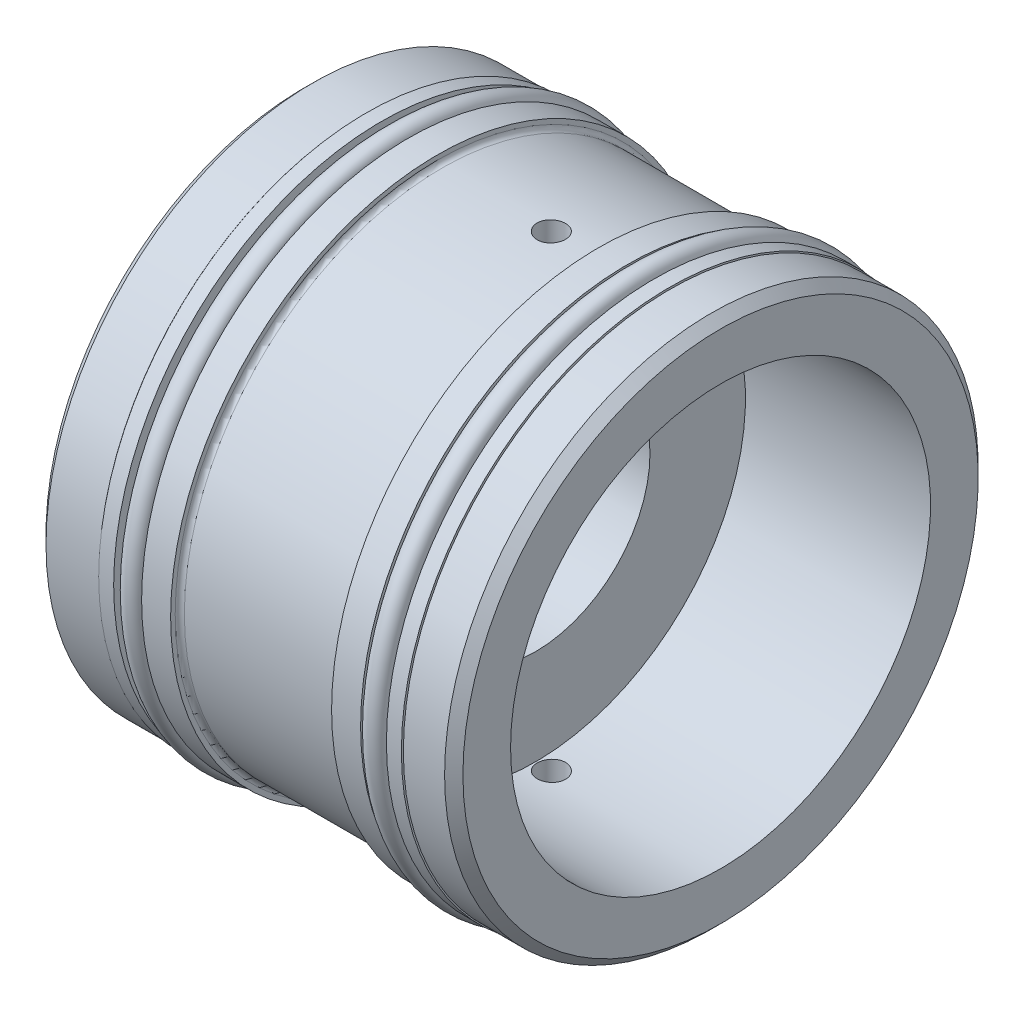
SolidWorks part; units mm, degrees
ref_plane "Front Plane" through (0, 0, 0) normal (0, 0, 1) x (1, 0, 0)
ref_plane "Top Plane" through (0, 0, 0) normal (0, 1, 0) x (1, 0, 0)
ref_plane "Right Plane" through (0, 0, 0) normal (1, 0, 0) x (0, 0, -1)
sketch "Sketch1" plane through (0, 0, 0) normal (0, 0, 1) x (1, 0, 0)
  line L0 (0, 0) -> (0, 45.5562) construction
  line L1 (0, 0) -> (32.8567, 0) construction
  line L2 (-17.3355, 9.525) -> (-17.3355, 22.1869)
  line L3 (-17.3355, 22.1869) -> (-12.1793, 22.1869)
  line L4 (-12.1793, 22.1869) -> (-12.1793, 20.9296)
  line L5 (-12.1793, 20.9296) -> (-8.6233, 20.9296)
  line L6 (-8.6233, 20.9296) -> (-8.6233, 22.1869)
  line L7 (-8.6233, 22.1869) -> (-6.2103, 22.1869)
  line L8 (-6.2103, 22.1869) -> (-6.2103, 21.4249)
  line L9 (-6.2103, 21.4249) -> (7.1755, 21.4249)
  line L10 (-17.3355, 9.525) -> (1.9431, 9.525)
  line L11 (1.9431, 9.525) -> (1.9431, 17.4625)
  line L12 (1.9431, 17.4625) -> (17.3355, 17.4625)
  line L13 (7.1755, 22.1869) -> (7.1755, 21.4249)
  line L14 (9.5885, 22.1869) -> (7.1755, 22.1869)
  line L15 (9.5885, 20.9296) -> (9.5885, 22.1869)
  line L16 (13.1445, 20.9296) -> (9.5885, 20.9296)
  line L17 (13.1445, 22.1869) -> (13.1445, 20.9296)
  line L18 (17.3355, 22.1869) -> (13.1445, 22.1869)
  line L19 (17.3355, 22.1869) -> (17.3355, 17.4625)
  dimension "D2" = 3.556
  dimension "D3" = 13.3858
  dimension "D4" = 44.3738
  dimension "D5" = 34.671
  dimension "D6" = 34.925
  dimension "D7" = 15.3924
  dimension "D8" = 42.8498
  dimension "D9" = 41.8592
  dimension "D10" = 19.05
  dimension "D11" = 29.5148
  dimension "D12" = 2.413
  dimension "D13" = 2.413
revolve "Revolve1" add sketch "Sketch1" angle 360 about L1
fillet "Fillet1" radius 0.381 2 edges at (7.1755, 0, 21.4249) (-6.2103, 0, 21.4249)
chamfer "Chamfer1" distance 0.762 angle 45 2 edges at (17.3355, 0, 22.1869) (-17.3355, 0, 22.1869)
sketch "Sketch6" plane through (0, 0, 0) normal (0, 0, 1) x (1, 0, 0)
  line L0 (0, 0) -> (49.5791, 0) construction
  line L1 (-17.3355, 21.4249) -> (-17.3355, -21.4249) construction
  line L2 (-8.6233, 20.9296) -> (-12.1793, 20.9296) construction
  line L3 (-12.1031, 20.9296) -> (-10.8585, 20.9296)
  line L4 (-12.1031, 20.9296) -> (-12.1031, 22.2758)
  line L5 (-12.1031, 22.2758) -> (-10.8585, 22.2758)
  line L6 (-10.8585, 20.9296) -> (-10.8585, 22.2758)
  line L7 (0.4826, 41.4439) -> (0.4826, -9.3524) construction
  line L8 (-12.1793, -22.1869) -> (-12.1793, 22.1869) construction
  line L9 (13.1445, 20.9296) -> (13.1445, -20.9296) construction
  line L10 (-8.6233, 22.1869) -> (-8.6233, -22.1869) construction
  line L11 (11.8237, 20.9296) -> (11.8237, 22.2758)
  line L12 (13.0683, 22.2758) -> (11.8237, 22.2758)
  line L13 (13.0683, 20.9296) -> (13.0683, 22.2758)
  line L14 (13.0683, 20.9296) -> (11.8237, 20.9296)
  circle A0 centre (-9.5885, 21.7424) radius 0.889
  circle A1 centre (10.5537, 21.7424) radius 0.889
  dimension "D4" = 1.778
  dimension "D5" = 43.4848
  dimension "D6" = 0.9652
  dimension "D1" = 1.2446
  dimension "D2" = 5.2324
  dimension "D3" = 44.5516
revolve "Revolve3" add sketch "Sketch6" angle 360 about L0
sketch "Sketch7" plane through (0, 0, 0) normal (0, 1, 0) x (0, 0, -1)
  line L1 (-21.4249, -17.3355) -> (21.4249, -17.3355) construction
  circle A0 centre (0, -3.2639) radius 1.1811
  dimension "D1" = 2.3622
  dimension "D2" = 14.0716
extrude "Cut-Extrude1" cut sketch "Sketch7" against normal through all and the other way through all
